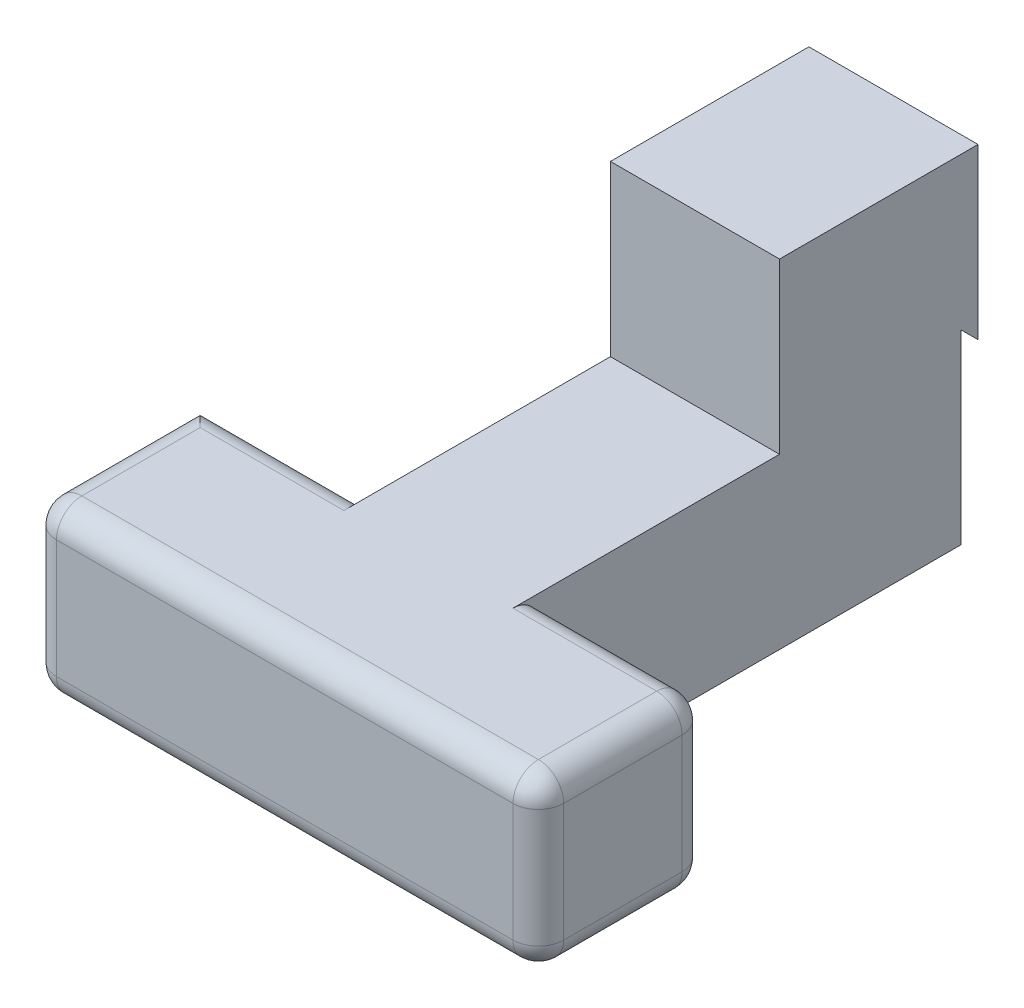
SolidWorks part; units mm, degrees
ref_plane "Front Plane" through (0, 0, 0) normal (0, 0, 1) x (1, 0, 0)
ref_plane "Top Plane" through (0, 0, 0) normal (0, 1, 0) x (1, 0, 0)
ref_plane "Right Plane" through (0, 0, 0) normal (1, 0, 0) x (0, 0, -1)
sketch "Sketch1" plane through (0, 0, 0) normal (0, 1, 0) x (1, 0, 0)
  line L0 (0, 0) -> (0, -32.9299) construction
  line L1 (10, -25) -> (-10, -25)
  line L2 (10, -25) -> (10, 25)
  line L3 (10, 25) -> (-10, 25)
  line L4 (-10, -25) -> (-10, 25)
  line L5 (10, -25) -> (-10, 25) construction
  line L6 (10, 25) -> (-10, -25) construction
  point P0 (0, 0)
  dimension "D1" = 50
  dimension "D2" = 20
extrude "Boss-Extrude1" add sketch "Sketch1" along normal mid plane 20
sketch "Sketch2" plane through (0, 0, 0) normal (0, 1, 0) x (1, 0, 0)
  line L0 (0, 0) -> (0, -35) construction
  line L2 (30, -45) -> (-30, -45)
  line L3 (30, -45) -> (30, -25)
  line L4 (30, -25) -> (-30, -25)
  line L5 (-30, -45) -> (-30, -25)
  line L6 (30, -45) -> (-30, -25) construction
  line L7 (30, -25) -> (-30, -45) construction
  dimension "D1" = 20
  dimension "D2" = 60
  dimension "D3" = 35
extrude "Boss-Extrude2" add sketch "Sketch2" along normal mid plane 20
sketch "Sketch4" plane through (0, 0, -25) normal (0, 0, -1) x (-1, 0, 0)
  circle A0 centre (0, 0) radius 5
  dimension "D1" = 10
extrude "Cut-Extrude1" cut sketch "Sketch4" against normal blind 20
sketch "Sketch5" plane through (0, 10, 0) normal (0, 1, 0) x (1, 0, 0)
  line L0 (0, 0) -> (0, 15.262) construction
  line L1 (10, 25) -> (-10, 25) construction
  line L2 (-10, 3.524) -> (10, 3.524)
  line L3 (-10, 3.524) -> (-10, 27)
  line L4 (-10, 27) -> (10, 27)
  line L5 (10, 3.524) -> (10, 27)
  line L6 (-10, 3.524) -> (10, 27) construction
  line L7 (-10, 27) -> (10, 3.524) construction
  dimension "D1" = 2
extrude "Boss-Extrude3" add sketch "Sketch5" along normal blind 20
fillet "Fillet2" radius 3 13 edges at (30, 0, 45) (-30, -10, 35) (-20, -10, 25) (20, -10, 25) (30, -10, 35) (20, 10, 25) (30, 10, 35) (-30, 0, 45) (0, 10, 45) (-20, 10, 25) (-30, 10, 35) (30, 0, 25) (0, -10, 45)
sketch "Sketch6" plane through (0, 0, 0) normal (1, 0, 0) x (0, 0, -1)
  line L0 (27, 10) -> (25, 10)
  line L1 (27, 30) -> (27, 10) construction
  line L2 (25, 10) -> (25, 12)
  line L3 (25, 12) -> (27, 10)
  dimension "D1" = 2
extrude "Cut-Extrude2" cut sketch "Sketch6" against normal mid plane 20
